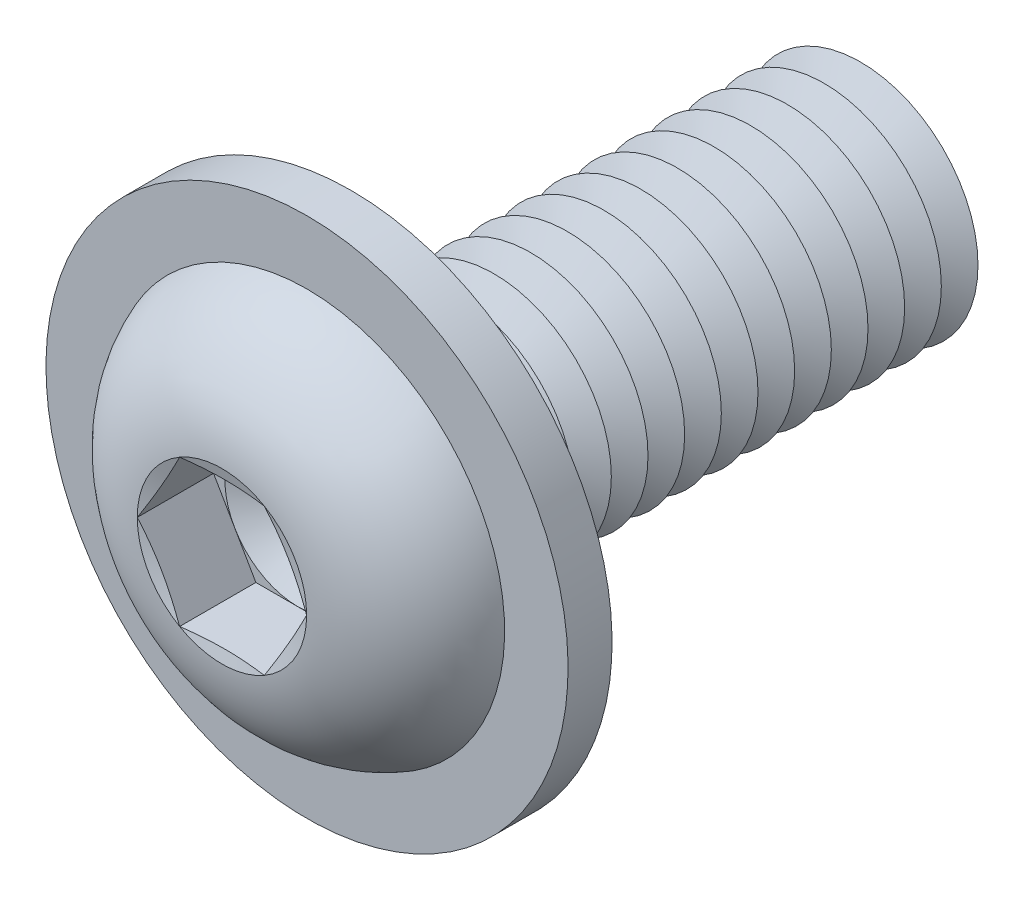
SolidWorks part; units mm, degrees
ref_plane "Front Plane" through (0, 0, 0) normal (0, 0, 1) x (1, 0, 0)
ref_plane "Top Plane" through (0, 0, 0) normal (0, 1, 0) x (1, 0, 0)
ref_plane "Right Plane" through (0, 0, 0) normal (1, 0, 0) x (0, 0, -1)
sketch "Sketch1" plane through (0, 0, 0) normal (1, 0, 0) x (0, 0, -1)
  line L0 (0, 4) -> (0, 7)
  line L3 (0, 4) -> (18, 4)
  line L4 (18, 4) -> (18, 0)
  line L5 (18, 0) -> (-4.4, 0) construction
  line L6 (-4.4, 0) -> (18, 0)
  line L7 (-4.4, 2.8867) -> (-4.4, 1.4434) construction
  line L8 (-4.4, 1.4434) -> (-4.4, 0)
  line L9 (-4.4, 2.8867) -> (-4.0132, 1.4434)
  line L10 (-4.0132, 1.4434) -> (-4.4, 1.4434)
  line L11 (18, 0) -> (22.7481, 0) construction
  line L12 (0, 7) -> (-4.4, 7) construction
  arc A1 (0, 7) -> (-4.4, 2.8867) centre (0, 2.59) ccw
  point P8 (18, 2)
  dimension "D1" = 14
  dimension "D2" = 8
  dimension "D3" = 4.4
  dimension "D4" = 5.7735
  dimension "D5" = 18
  dimension "D6" = 15
revolve "Revolve1" add sketch "Sketch1" angle 360 about L5
fillet "Fillet1" radius 0.625 1 edges at (-4, 0, 0)
sketch "Sketch2" plane through (0, 0, 0) normal (1, 0, 0) x (0, 0, -1)
  line L0 (17.375, 4) -> (18.625, 4)
  line L1 (18, 4) -> (0.625, 4) construction
  line L2 (18.625, 4) -> (18, 2.9175)
  line L3 (18, -4) -> (18, 4) construction
  line L4 (18, 2.9175) -> (17.375, 4)
  dimension "D1" = 1.25
revolve "Cut-Revolve1" cut sketch "Sketch2" angle 360 about axis through (0, 0, -18) along (0, 0, -1)
pattern_linear "LPattern1" count 14 spacing 1.25 along (0, 0, 1) of "Cut-Revolve1"
sketch "Sketch3" plane through (0, 0, 4.4) normal (0, 0, 1) x (1, 0, 0)
  line L7 (1.4434, 2.5) -> (-1.4434, 2.5)
  line L8 (-1.4434, 2.5) -> (-2.8867, 0)
  line L9 (-2.8867, 0) -> (-1.4434, -2.5)
  line L10 (-1.4434, -2.5) -> (1.4434, -2.5)
  line L11 (1.4434, -2.5) -> (2.8867, 0)
  line L12 (2.8867, 0) -> (1.4434, 2.5)
  circle A0 centre (0, 0) radius 2.5 construction
  circle A3 centre (0, 0) radius 2.8867 construction
extrude "Cut-Extrude1" cut sketch "Sketch3" against normal blind 2.6
sketch "Sketch4" plane through (0, 0, 1.8) normal (0, 0, 1) x (1, 0, 0)
  line L1 (1.4434, 2.5) -> (-1.4434, 2.5) construction
  circle A0 centre (0, 0) radius 2.5
extrude "Cut-Extrude2" cut sketch "Sketch4" against normal through all draft 60
sketch "Sketch5" plane through (0, 0, 0) normal (0, 0, -1) x (-1, 0, 0)
  circle A0 centre (0, 0) radius 8.9
  circle A1 centre (0, 0) radius 4.625
  circle A2 centre (0, 0) radius 4.625 construction
  dimension "D1" = 17.8
extrude "Boss-Extrude1" add sketch "Sketch5" against normal blind 1.5
